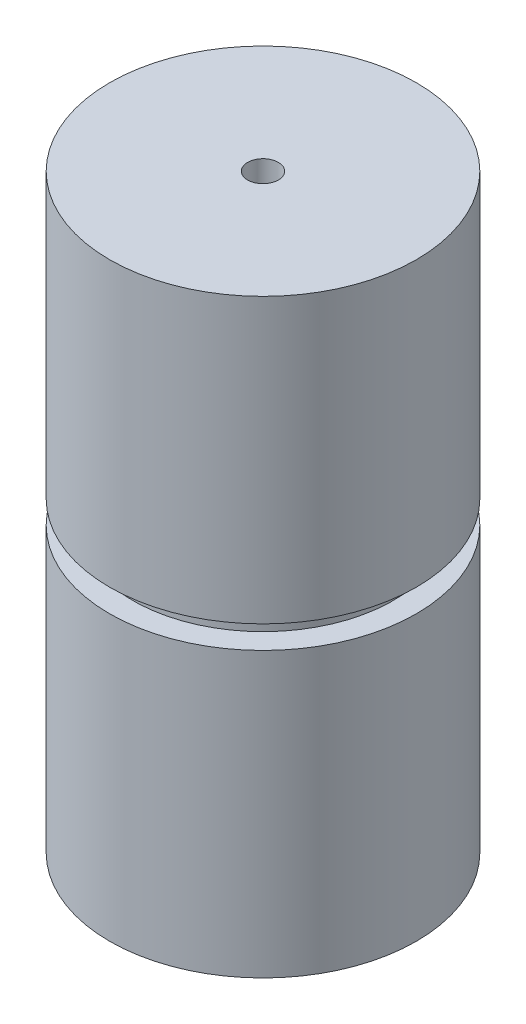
SolidWorks part; units mm, degrees
ref_plane "Front" through (0, 0, 0) normal (0, 0, 1) x (1, 0, 0)
ref_plane "Top" through (0, 0, 0) normal (0, 1, 0) x (1, 0, 0)
ref_plane "Right" through (0, 0, 0) normal (1, 0, 0) x (0, 0, -1)
sketch "Sketch1" plane through (0, 0, 0) normal (0, 1, 0) x (1, 0, 0)
  circle A0 centre (0, 0) radius 17
extrude "Extrude1" add sketch "Sketch1" along normal blind 3
sketch "Sketch2" plane through (0, 3, 0) normal (0, 1, 0) x (-1, 0, 0)
  circle A0 centre (0, 0) radius 20
extrude "Extrude2" add sketch "Sketch2" along normal blind 37
sketch "Sketch3" plane through (0, 0, 0) normal (0, -1, 0) x (1, 0, 0)
  circle A0 centre (0, 0) radius 20
extrude "Extrude3" add sketch "Sketch3" along normal blind 37
sketch "Sketch4" plane through (0, 40, 0) normal (0, 1, 0) x (-1, 0, 0)
  circle A0 centre (0, 0) radius 2
extrude "Cut-Extrude1" cut sketch "Sketch4" against normal blind 16
sketch "Sketch5" plane through (0, -37, 0) normal (0, -1, 0) x (1, 0, 0)
  circle A0 centre (0, 0) radius 2
extrude "Cut-Extrude2" cut sketch "Sketch5" against normal blind 16
